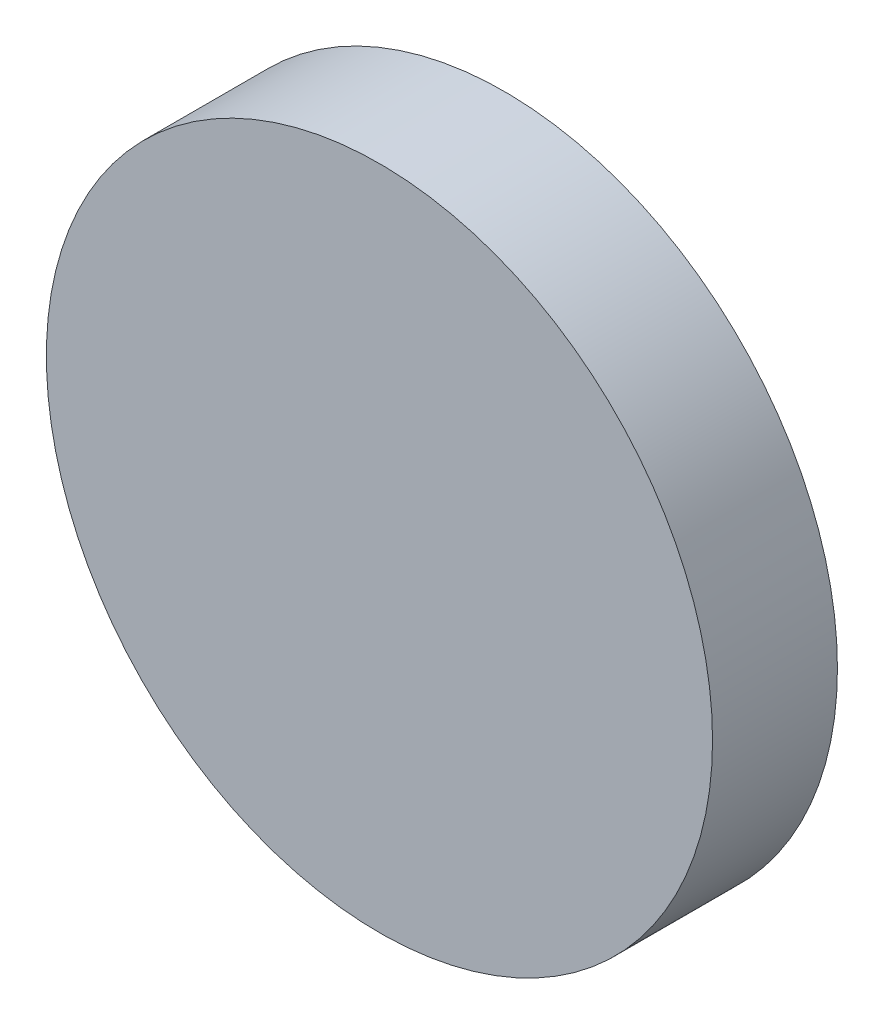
SolidWorks part; units mm, degrees
ref_plane "Front Plane" through (0, 0, 0) normal (0, 0, 1) x (1, 0, 0)
ref_plane "Top Plane" through (0, 0, 0) normal (0, 1, 0) x (1, 0, 0)
ref_plane "Right Plane" through (0, 0, 0) normal (1, 0, 0) x (0, 0, -1)
sketch "Sketch1" plane through (0, 0, 0) normal (0, 0, 1) x (1, 0, 0)
  circle A0 centre (0, 0) radius 25.4
  dimension "D1" = 50.8
extrude "Boss-Extrude1" add sketch "Sketch1" along normal blind 9.525
